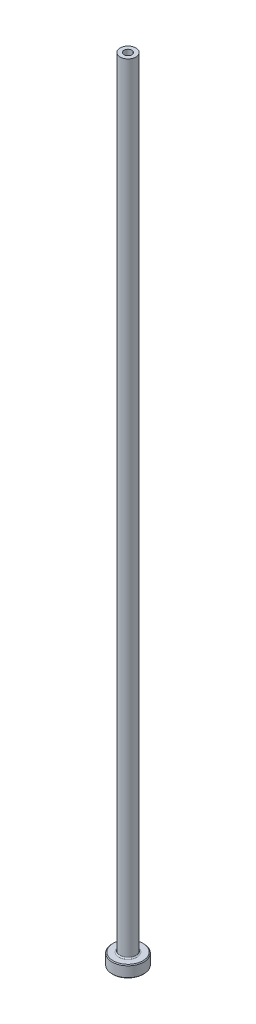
SolidWorks part; units mm, degrees
ref_plane "Front Plane" through (0, 0, 0) normal (0, 0, 1) x (1, 0, 0)
ref_plane "Top Plane" through (0, 0, 0) normal (0, 1, 0) x (1, 0, 0)
ref_plane "Right Plane" through (0, 0, 0) normal (1, 0, 0) x (0, 0, -1)
sketch "Sketch1" plane through (0, 0, 0) normal (0, 0, 1) x (1, 0, 0)
  line L0 (-1, 200) -> (-2, 200)
  line L1 (-2, 200) -> (-2, 3)
  line L2 (-2, 3) -> (-4, 3)
  line L3 (-4, 3) -> (-4, 0)
  line L4 (4.4, 0) -> (-4.4, 0) construction
  line L5 (-4, 0) -> (-1.25, 0)
  line L6 (-1, 165) -> (-1, 200)
  line L7 (0, 92.1877) -> (0, -15.5353) construction
  line L8 (0, -4.4) -> (0, 4.4) construction
  line L9 (-1, 165) -> (-1.25, 153)
  line L10 (-1.25, 153) -> (-1.25, 0)
  dimension "D1" = 0.25
  dimension "ID" = 2
  dimension "OD" = 4
  dimension "L" = 200
  dimension "H" = 8
  dimension "T" = 3
  dimension "N" = 35
  dimension "D2" = 12
revolve "Revolve1" add sketch "Sketch1" angle 360 about L7
fillet "Fillet1" radius 0.3 1 edges at (0, 3, 2)
chamfer "Chamfer1" distance 0.2 angle 45 2 edges at (0, 3, 4) (0, 0, 4)
chamfer "Chamfer3" distance 0.5 angle 45 1 edges at (0, 0, 1.25)
